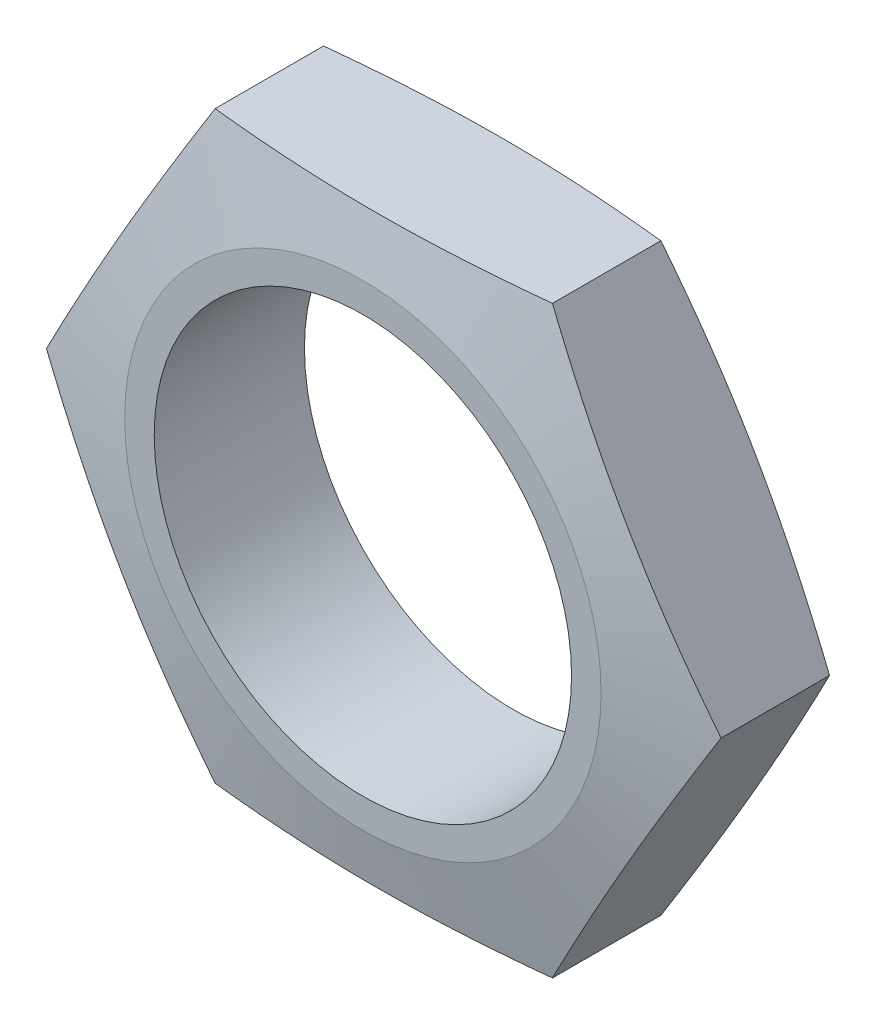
SolidWorks part; units mm, degrees
ref_plane "Front" through (0, 0, 0) normal (0, 0, 1) x (1, 0, 0)
ref_plane "Top" through (0, 0, 0) normal (0, 1, 0) x (1, 0, 0)
ref_plane "Right" through (0, 0, 0) normal (1, 0, 0) x (0, 0, -1)
sketch "Sketch2" plane through (0, 0, 0) normal (0, 0, 1) x (1, 0, 0)
  line L1 (5.1326, -8.89) -> (10.2653, 0)
  line L2 (10.2653, 0) -> (5.1326, 8.89)
  line L3 (5.1326, 8.89) -> (-5.1326, 8.89)
  line L4 (-5.1326, 8.89) -> (-10.2653, 0)
  line L5 (-10.2653, 0) -> (-5.1326, -8.89)
  line L6 (-5.1326, -8.89) -> (5.1326, -8.89)
  circle A0 centre (0, 0) radius 6.35
  circle A1 centre (0, 0) radius 8.89 construction
  dimension "缸径" = 12.7
  dimension "螺母大径" = 17.78
extrude "Base-Extrude" add sketch "Sketch2" along normal mid plane 4.572
sketch "Sketch4" plane through (0, 0, 0) normal (0, 1, 0) x (1, 0, 0)
  line L0 (0, 3.558) -> (0, -4.5381) construction
  line L1 (0, -2.286) -> (0, 2.286) construction
  line L2 (8.9057, 0) -> (2.7758, 0) construction
  line L3 (7.2479, 2.286) -> (10.2653, 1.6496)
  line L4 (10.2653, 2.286) -> (5.1326, 2.286) construction
  line L5 (10.2653, -2.286) -> (10.2653, 2.286) construction
  line L6 (7.2479, -2.286) -> (10.2653, -1.6496)
  line L7 (10.2653, 1.6496) -> (10.2653, 2.286)
  line L8 (10.2653, -1.6496) -> (10.2653, -2.286)
  line L9 (10.2653, 2.286) -> (7.2479, 2.286)
  line L10 (10.2653, -2.286) -> (7.2479, -2.286)
revolve "Cut-Revolve1" cut sketch "Sketch4" angle 360 about L0
